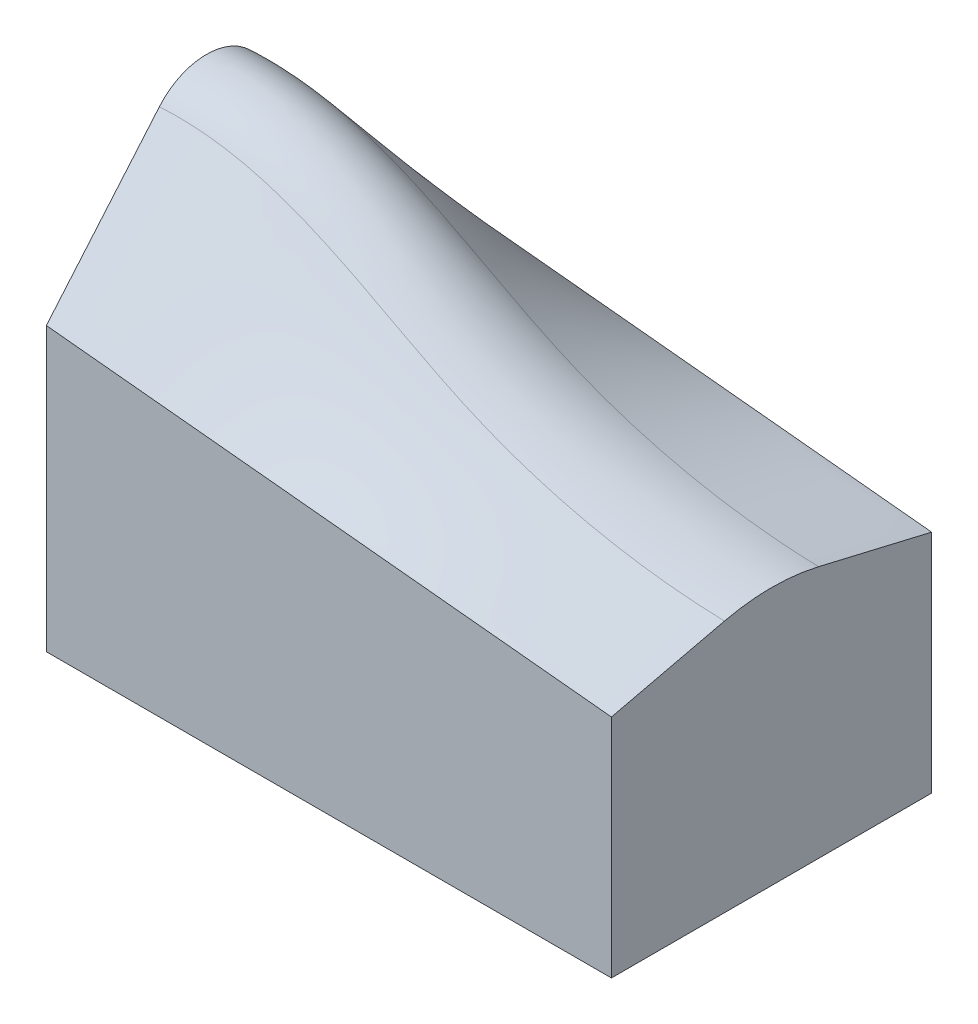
SolidWorks part; units mm, degrees
ref_plane "Front Plane" through (0, 0, 0) normal (0, 0, 1) x (1, 0, 0)
ref_plane "Top Plane" through (0, 0, 0) normal (0, 1, 0) x (1, 0, 0)
ref_plane "Right Plane" through (0, 0, 0) normal (1, 0, 0) x (0, 0, -1)
sketch "Sketch1" plane through (0, 0, 0) normal (1, 0, 0) x (0, 0, -1)
  line L0 (-8.5, 6) -> (0, 8)
  line L1 (-8.5, -6) -> (8.5, -6)
  line L2 (-8.5, -6) -> (-8.5, 6)
  line L3 (-8.5, 6) -> (8.5, 6) construction
  line L4 (8.5, -6) -> (8.5, 6)
  line L5 (-8.5, -6) -> (8.5, 6) construction
  line L6 (-8.5, 6) -> (8.5, -6) construction
  line L7 (0, 8) -> (8.5, 6)
  line L8 (0, 8) -> (0, 0) construction
  point P0 (0, 0)
  dimension "D1" = 17
  dimension "D2" = 12
  dimension "D3" = 14
ref_plane "Plane1" through (-30, 0, 0) normal (1, 0, 0) x (0, 0, -1)
sketch "Sketch2" plane through (-30, 0, 0) normal (1, 0, 0) x (0, 0, -1)
  line L0 (-8.5, 9) -> (0, 19)
  line L1 (-8.5, -6) -> (8.5, -6)
  line L2 (-8.5, -6) -> (-8.5, 9)
  line L3 (-8.5, 9) -> (8.5, 9) construction
  line L4 (8.5, -6) -> (8.5, 9)
  line L7 (0, 19) -> (8.5, 9)
  line L8 (0, 19) -> (0, 0) construction
  point P0 (0, 0)
  dimension "D1" = 17
  dimension "D2" = 6
  dimension "D3" = 15
  dimension "D4" = 25
sketch "Sketch3" plane through (0, 0, 0) normal (0, 0, 1) x (1, 0, 0)
  spline S0 degree 3 poles (-30, 19) (-22.8511, 19.7948) (-15.7093, 10.6022) (-4.6735, 7.9948) (0, 8) knots 0 0 0 0 0.565401 1 1 1 1
loft "Loft1" add profiles "Sketch1", "Sketch2"
fillet "Fillet1" radius 5 3 edges
